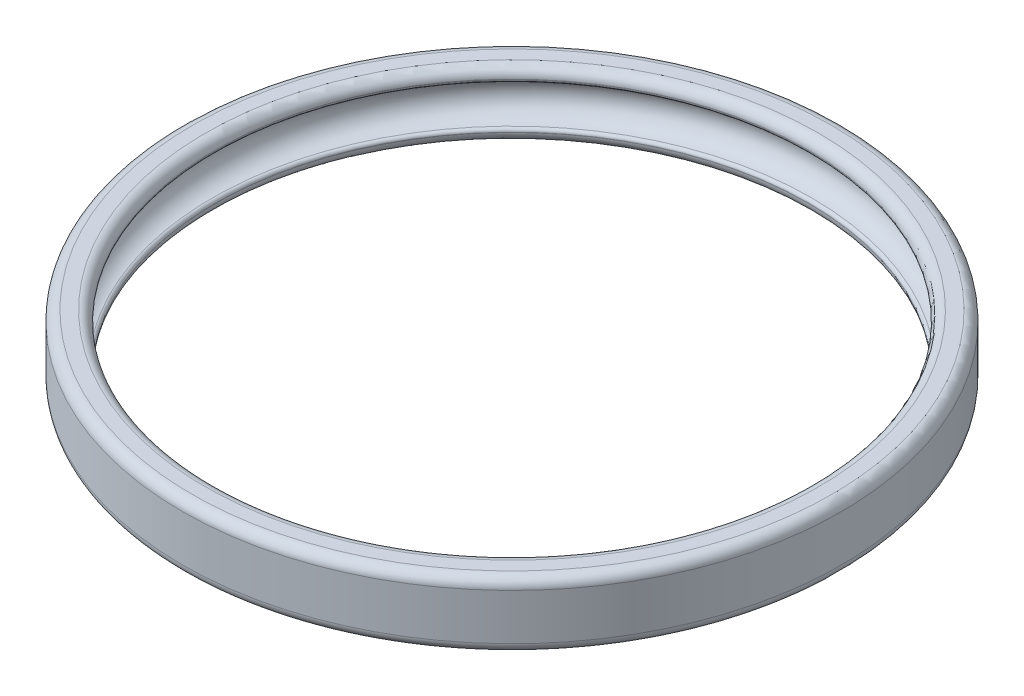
SolidWorks part; units mm, degrees
ref_plane "前视基准面" through (0, 0, 0) normal (0, 0, 1) x (1, 0, 0)
ref_plane "上视基准面" through (0, 0, 0) normal (0, 1, 0) x (1, 0, 0)
ref_plane "右视基准面" through (0, 0, 0) normal (1, 0, 0) x (0, 0, -1)
sketch "草图1" plane through (0, 0, 0) normal (0, 0, 1) x (1, 0, 0)
  line L0 (0, 0) -> (0, 47.0541) construction
  line L1 (45, 8.4641) -> (45, 8.5)
  line L2 (46.5, 0) -> (48.5, 0)
  line L3 (45, 1.5) -> (45, 1.5359)
  line L4 (46.5, 10) -> (48.5, 10)
  line L5 (50, 1.5) -> (50, 8.5)
  arc A0 (45.4286, 2.0308) -> (45.4286, 7.9692) centre (45, 5) ccw
  arc A1 (45, 8.5) -> (46.5, 10) centre (46.5, 8.5) cw
  arc A2 (46.5, 0) -> (45, 1.5) centre (46.5, 1.5) cw
  arc A3 (48.5, 0) -> (50, 1.5) centre (48.5, 1.5) ccw
  arc A4 (48.5, 10) -> (50, 8.5) centre (48.5, 8.5) cw
  arc A5 (45.4286, 7.9692) -> (45, 8.4641) centre (45.5, 8.4641) cw
  arc A6 (45.4286, 2.0308) -> (45, 1.5359) centre (45.5, 1.5359) ccw
  point P12 (45, 10)
  point P17 (50, 0)
  point P20 (50, 10)
  point P23 (45, 8)
revolve "旋转1" add sketch "草图1" angle 360 about L0
equation "\"len1\"= 50"
equation "\"len2\"= 45"
equation "\"len3\"= 40"
equation "\"D1@草图1\"=\"len1\""
